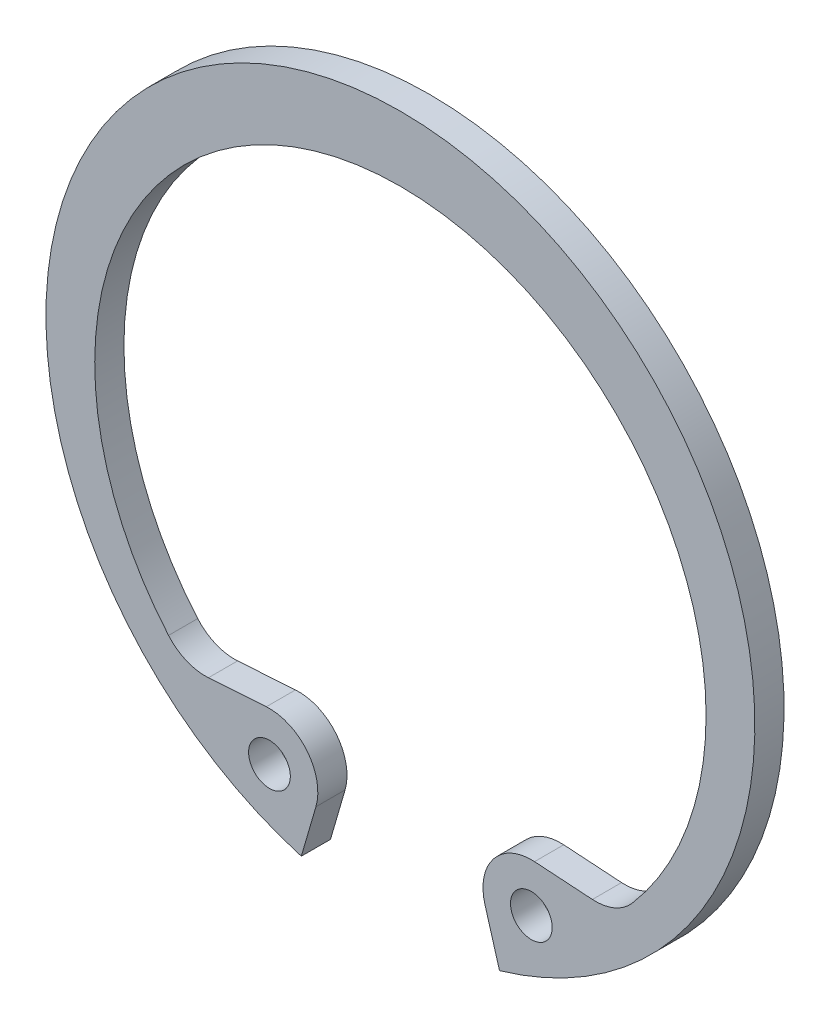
SolidWorks part; units mm, degrees
ref_plane "Face" through (0, 0, 0) normal (0, 0, 1) x (1, 0, 0)
ref_plane "Dessus" through (0, 0, 0) normal (0, 1, 0) x (1, 0, 0)
ref_plane "Droite" through (0, 0, 0) normal (1, 0, 0) x (0, 0, -1)
sketch "Esquisse1" plane through (0, 0, 0) normal (0, 0, 1) x (1, 0, 0)
  line L0 (0, 17.35) -> (0, 21.25) construction
  line L1 (5.0659, -17.3968) -> (5.9411, -20.4026)
  line L2 (6.6096, -13.9648) -> (9.0909, -19.2073) construction
  line L3 (11.5097, -13.9206) -> (8.0406, -13.6923)
  line L4 (-11.5097, -13.9206) -> (-8.0406, -13.6923)
  line L5 (-5.0659, -17.3968) -> (-5.9411, -20.4026)
  line L6 (6.3682, -17.4965) -> (7.4389, -20.4383) construction
  line L7 (-6.3682, -17.4965) -> (-7.4389, -20.4383) construction
  arc A0 (5.9411, -20.4026) -> (-5.9411, -20.4026) centre (0, 0) ccw
  arc A1 (13.8998, -12.9166) -> (-13.8998, -12.9166) centre (0, -0.975) ccw
  arc A2 (8.0406, -13.6923) -> (5.0659, -17.3968) centre (7.8502, -16.586) ccw
  arc A3 (11.5097, -13.9206) -> (13.8998, -12.9166) centre (11.7001, -11.0268) ccw
  circle A4 centre (7.8502, -16.586) radius 1.25
  arc A5 (-11.5097, -13.9206) -> (-13.8998, -12.9166) centre (-11.7001, -11.0268) cw
  circle A6 centre (-7.8502, -16.586) radius 1.25
  arc A7 (-8.0406, -13.6923) -> (-5.0659, -17.3968) centre (-7.8502, -16.586) cw
  arc A8 (7.4389, -20.4383) -> (-7.4389, -20.4383) centre (0, 0) ccw construction
  circle A9 centre (0, 0) radius 20 construction
  dimension "dgorge" = 42.5
  dimension "D3" = 0.975
  dimension "dtrou" = 2.5
  dimension "dext" = 43.5
  dimension "dn" = 40
  dimension "b" = 3.9
  dimension "a" = 5.8
  dimension "D5" = 70
  dimension "D7" = 32.471
  dimension "D9" = 40
extrude "Base-Extrusion" add sketch "Esquisse1" along normal blind 1.75
equation "\"D3@Esquisse1\" = \"b@Esquisse1\"/4"
equation "\"D7@Esquisse1\" = 360-(360-\"D9@Esquisse1\")*\"dext@Esquisse1\"/\"dgorge@Esquisse1\""
